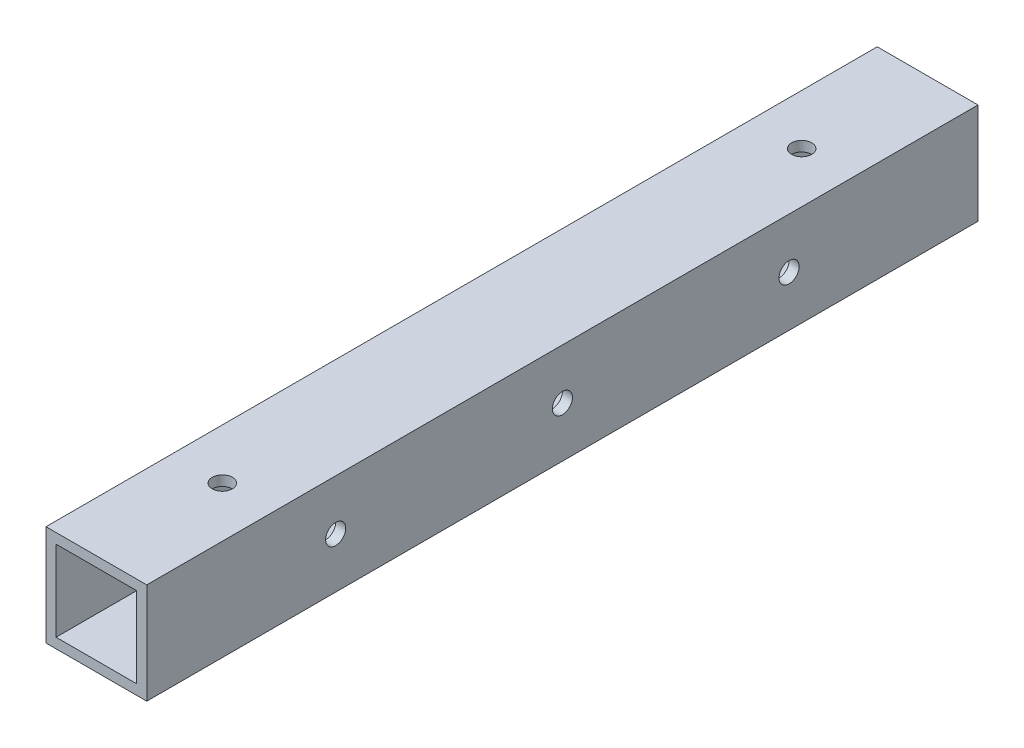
SolidWorks part; units mm, degrees
ref_plane "前视基准面" through (0, 0, 0) normal (0, 0, 1) x (1, 0, 0)
ref_plane "上视基准面" through (0, 0, 0) normal (0, 1, 0) x (1, 0, 0)
ref_plane "右视基准面" through (0, 0, 0) normal (1, 0, 0) x (0, 0, -1)
sketch "草图1" plane through (0, 0, 0) normal (0, 0, 1) x (1, 0, 0)
  line L0 (-8, 8) -> (8, 8)
  line L1 (-10, 10) -> (10, 10)
  line L2 (-10, 10) -> (-10, -10)
  line L3 (-10, -10) -> (10, -10)
  line L4 (10, 10) -> (10, -10)
  line L5 (-10, 10) -> (10, -10) construction
  line L6 (-10, -10) -> (10, 10) construction
  line L7 (8, 8) -> (8, -8)
  line L8 (-8, -8) -> (8, -8)
  line L9 (-8, 8) -> (-8, -8)
  point P0 (0, 0)
  dimension "D1" = 20
  dimension "D2" = 20
  dimension "D3" = 2
extrude "凸台-拉伸1" add sketch "草图1" along normal blind 165
hole_wizard "Ø4.0 (4) 直径孔1" positions "草图2" profile "草图3" hole size "Ø4.0" standard "GB"
sketch "草图2" plane through (0, 10, 0) normal (0, 1, 0) x (1, 0, 0)
  line L0 (10, 0) -> (-10, 0) construction
  line L1 (10, -165) -> (-10, -165) construction
  line L2 (10, -165) -> (10, 0) construction
  point P0 (0, -140)
  point P2 (0, -25)
  dimension "D1" = 25
  dimension "D2" = 25
  dimension "D3" = 10
  dimension "D4" = 10
sketch "草图3" plane through (0, 10, 140) normal (1, 0, 0) x (0, 0, 1)
  line L0 (0, 0) -> (0, 20)
  line L1 (0, 20) -> (2, 20)
  line L2 (2, 20) -> (2, 0)
  line L5 (2, 0) -> (0, 0)
  line L11 (0, -6.35) -> (0, 107.95) construction
  dimension "通孔孔直径" = 4
  dimension "通孔孔深度" = 20
hole_wizard "Ø4.0 (4) 直径孔2" positions "草图4" profile "草图5" hole size "Ø4.0" standard "GB"
sketch "草图4" plane through (-10, 0, 0) normal (-1, 0, 0) x (0, 0, 1)
  point P0 (37.5, 0)
  point P3 (82.5, 0)
  point P6 (127.5, 0)
sketch "草图5" plane through (-10, 0, 37.5) normal (0, 1, 0) x (0, 0, 1)
  line L0 (0, 0) -> (0, 20)
  line L1 (0, 20) -> (2, 20)
  line L2 (2, 20) -> (2, 0)
  line L5 (2, 0) -> (0, 0)
  line L11 (0, -6.35) -> (0, 107.95) construction
  dimension "通孔孔直径" = 4
  dimension "通孔孔深度" = 20
